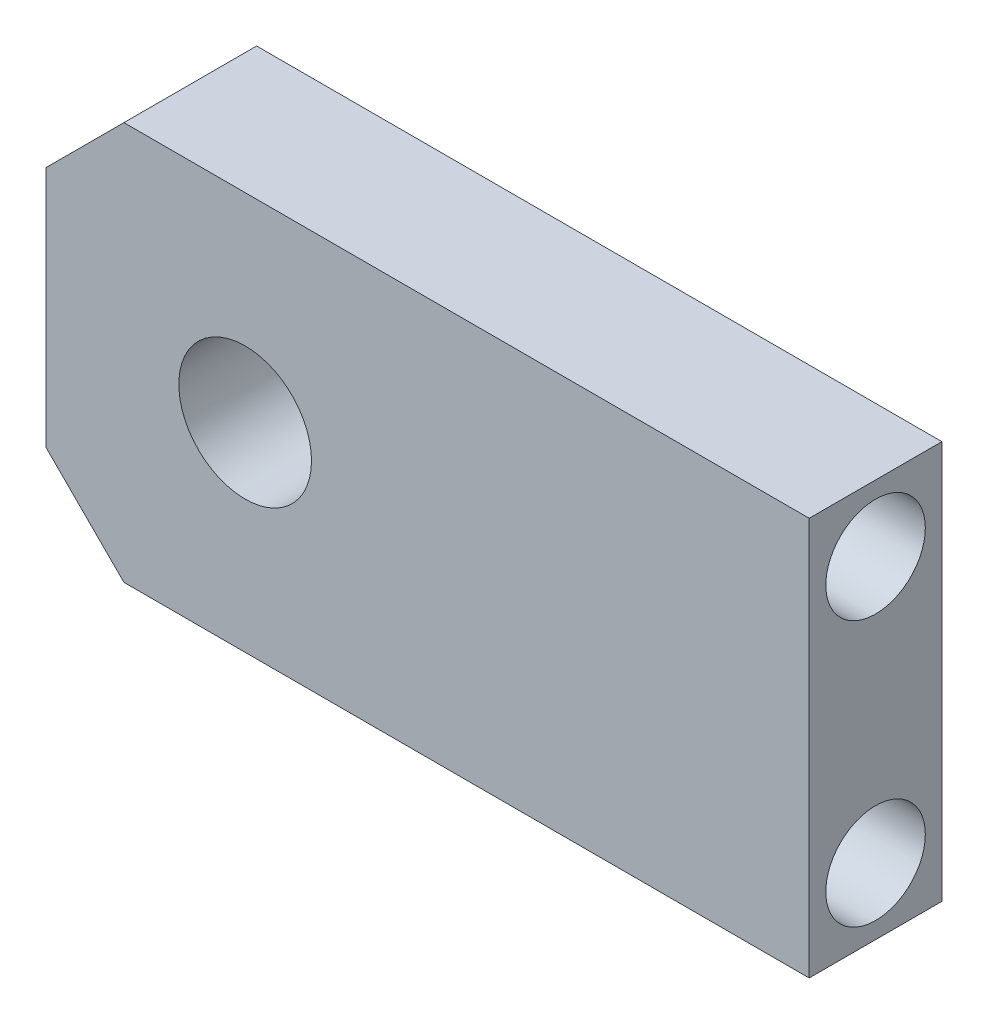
SolidWorks part; units mm, degrees
ref_plane "Front Plane" through (0, 0, 0) normal (0, 0, 1) x (1, 0, 0)
ref_plane "Top Plane" through (0, 0, 0) normal (0, 1, 0) x (1, 0, 0)
ref_plane "Right Plane" through (0, 0, 0) normal (1, 0, 0) x (0, 0, -1)
sketch "Sketch1" plane through (0, 0, 0) normal (0, 0, 1) x (1, 0, 0)
  line L0 (0, 0) -> (0, -6011.1603) construction
  line L1 (0, 0) -> (6011.1603, 0) construction
  line L2 (-13.9433, -3.6544) -> (-13.9433, 3.6544)
  line L3 (-13.9433, 3.6544) -> (-11.5977, 6)
  line L4 (-11.5977, 6) -> (9.0567, 6)
  line L7 (-11.5977, -6) -> (9.0567, -6)
  line L8 (-13.9433, -3.6544) -> (-11.5977, -6)
  line L9 (9.0567, 6) -> (9.0567, -6)
  point P11 (11.4023, 0)
  point P13 (-13.9433, 0)
  dimension "D1" = 23
  dimension "D2" = 45
  dimension "D3" = 6
  dimension "D4" = 20.6544
extrude "Boss-Extrude1" add sketch "Sketch1" along normal blind 4
sketch "Sketch2" plane through (9.0567, 0, 0) normal (1, 0, 0) x (0, 0, -1)
  line L0 (0, -6) -> (0, 6) construction
  line L1 (-4, -6) -> (-4, 6) construction
  line L2 (-4, -6) -> (0, -6) construction
  line L3 (-4, 6) -> (0, 6) construction
  circle A0 centre (-2, 4) radius 1.5
  circle A1 centre (-2, -4) radius 1.5
  point P4 (-1.9665, 4.1586)
  point P5 (0, 0)
  point P8 (-2, -3.8072)
  dimension "D5" = 3
  dimension "D6" = 3
  dimension "D1" = 2
  dimension "D2" = 2
  dimension "D3" = 2
  dimension "D4" = 2
extrude "Cut-Extrude1" cut sketch "Sketch2" against normal blind 10
sketch "Sketch4" plane through (0, 0, 4) normal (0, 0, 1) x (1, 0, 0)
  line L0 (9.0567, -6) -> (9.0567, 6) construction
  circle A0 centre (-7.9433, 0) radius 2
  dimension "D2" = 4
  dimension "D1" = 17
  dimension "D3" = 7.9433
extrude "Cut-Extrude2" cut sketch "Sketch4" against normal blind 10 contours A0
